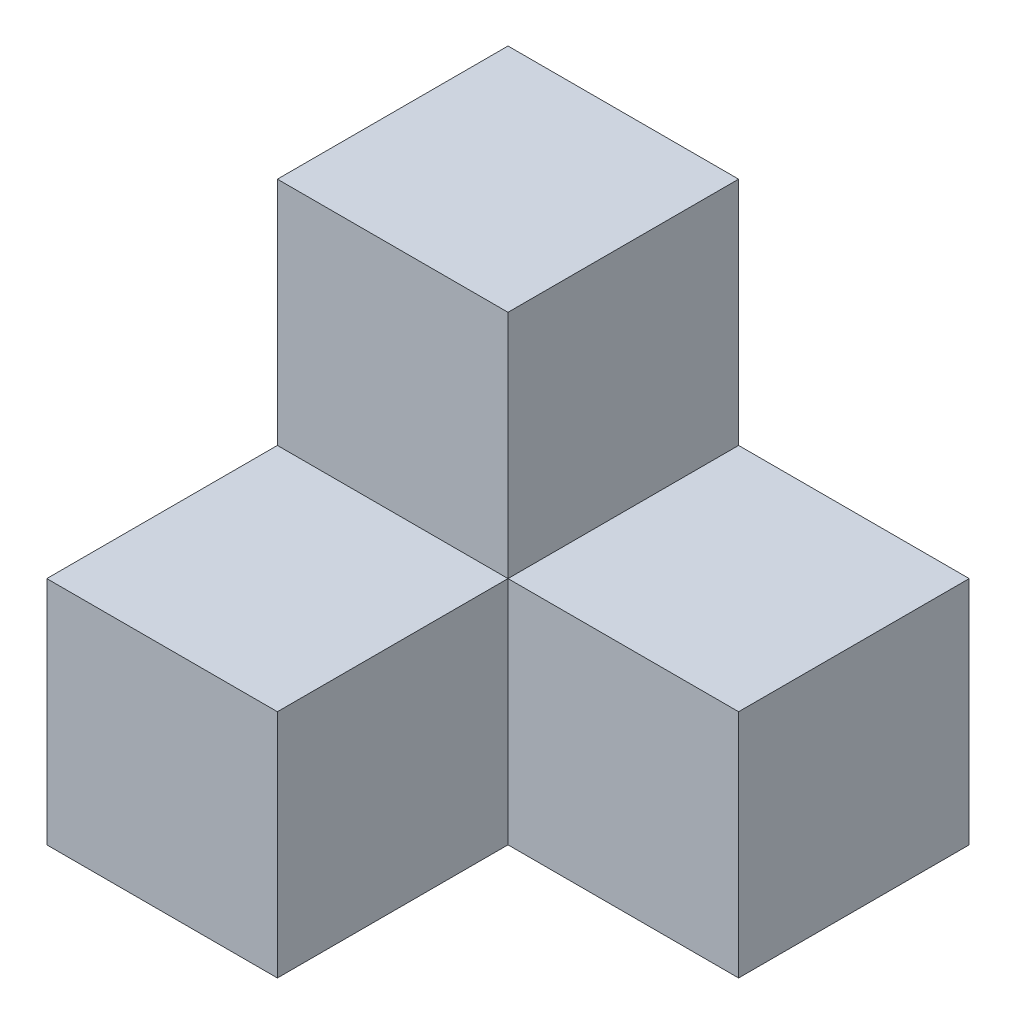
SolidWorks part; units mm, degrees
ref_plane "Piano frontale" through (0, 0, 0) normal (0, 0, 1) x (1, 0, 0)
ref_plane "Piano superiore" through (0, 0, 0) normal (0, 1, 0) x (1, 0, 0)
ref_plane "Piano destro" through (0, 0, 0) normal (1, 0, 0) x (0, 0, -1)
sketch "Sketch1" plane through (0, 0, 0) normal (0, 0, 1) x (1, 0, 0)
  line L0 (0, 2.5) -> (5, 2.5)
  line L1 (5, -2.5) -> (-5, -2.5)
  line L2 (5, -2.5) -> (5, 2.5)
  line L4 (-5, -2.5) -> (-5, 2.5)
  line L5 (5, -2.5) -> (-5, 2.5) construction
  line L6 (5, 2.5) -> (-5, -2.5) construction
  line L8 (-5, 2.5) -> (-5, 7.5)
  line L9 (-5, 7.5) -> (0, 7.5)
  line L10 (0, 2.5) -> (0, 7.5)
  point P0 (0, 0)
  dimension "D1" = 10
  dimension "D2" = 5
  dimension "D3" = 5
  dimension "D4" = 5
extrude "Boss-Extrude1" add sketch "Sketch1" along normal blind 5
sketch "Sketch2" plane through (0, 0, 5) normal (0, 0, 1) x (1, 0, 0)
  line L1 (0, 2.5) -> (-5, 2.5)
  line L2 (0, 2.5) -> (0, -2.5)
  line L3 (0, -2.5) -> (-5, -2.5)
  line L4 (-5, 2.5) -> (-5, -2.5)
extrude "Boss-Extrude2" add sketch "Sketch2" along normal blind 5
